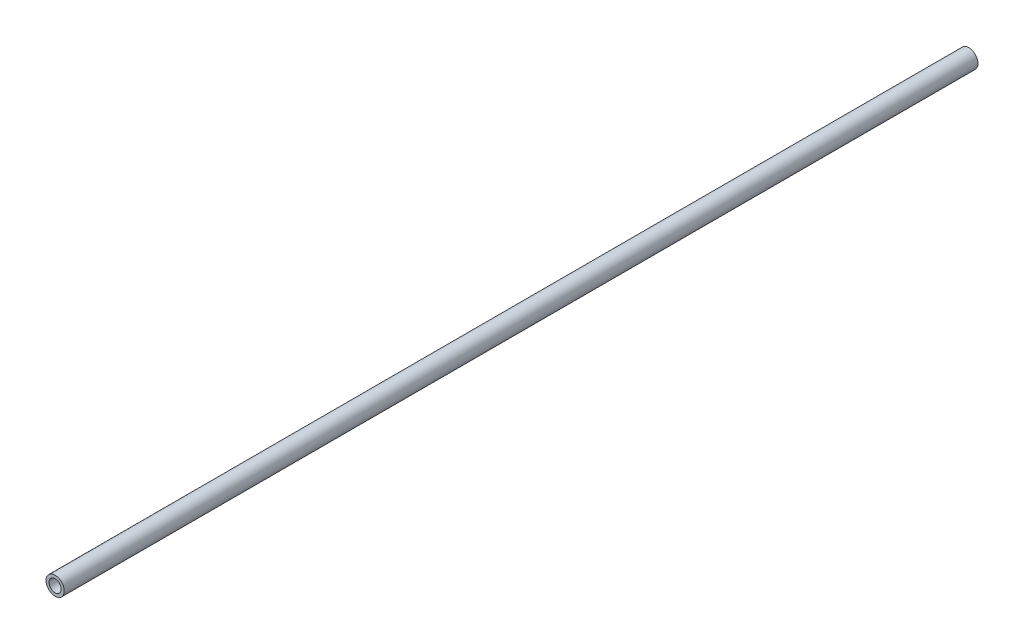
SolidWorks part; units mm, degrees
ref_plane "Płaszczyzna przednia" through (0, 0, 0) normal (0, 0, 1) x (1, 0, 0)
ref_plane "Płaszczyzna górna" through (0, 0, 0) normal (0, 1, 0) x (1, 0, 0)
ref_plane "Płaszczyzna prawa" through (0, 0, 0) normal (1, 0, 0) x (0, 0, -1)
sketch "Szkic1" plane through (0, 0, 0) normal (0, 0, 1) x (1, 0, 0)
  circle A0 centre (0, 0) radius 2
  circle A1 centre (0, 0) radius 3
  dimension "D1" = 4
  dimension "D2" = 6
extrude "Dodanie-wyciągnięcie1" add sketch "Szkic1" along normal blind 300
